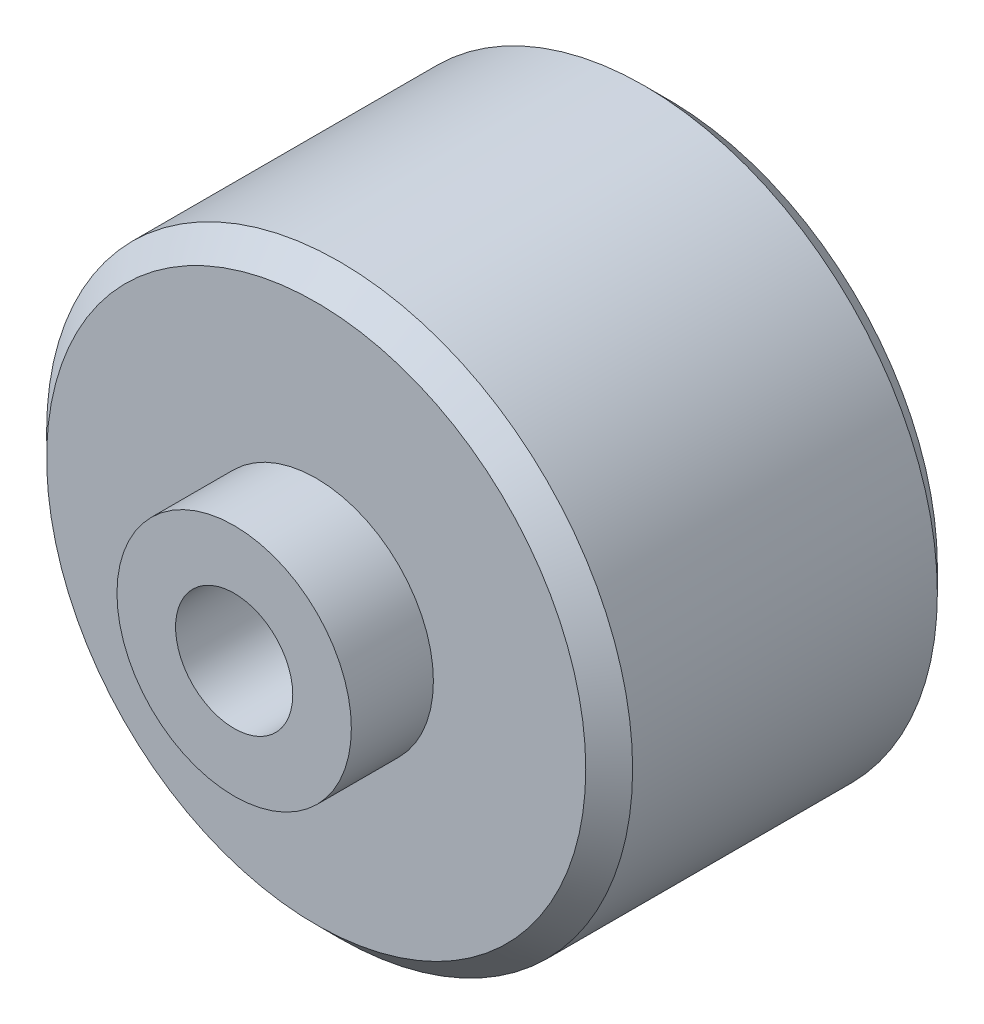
SolidWorks part; units mm, degrees
ref_plane "Front Plane" through (0, 0, 0) normal (0, 0, 1) x (1, 0, 0)
ref_plane "Top Plane" through (0, 0, 0) normal (0, 1, 0) x (1, 0, 0)
ref_plane "Right Plane" through (0, 0, 0) normal (1, 0, 0) x (0, 0, -1)
sketch "Sketch1" plane through (0, 0, 0) normal (0, 0, 1) x (1, 0, 0)
  circle A0 centre (0, 0) radius 12.5
  dimension "D1" = 25
extrude "Extrude1" add sketch "Sketch1" along normal blind 15
sketch "Sketch2" plane through (0, 0, 15) normal (0, 0, 1) x (1, 0, 0)
  circle A0 centre (0, 0) radius 5
extrude "Extrude2" add sketch "Sketch2" along normal blind 3.5
sketch "Sketch3" plane through (0, 0, 18.5) normal (0, 0, 1) x (1, 0, 0)
  circle A0 centre (0, 0) radius 2.5
extrude "Extrude3" cut sketch "Sketch3" against normal through all
chamfer "Chamfer1" distance 1 angle 45 2 edges at (12.5, 0, 0) (12.5, 0, 15)
